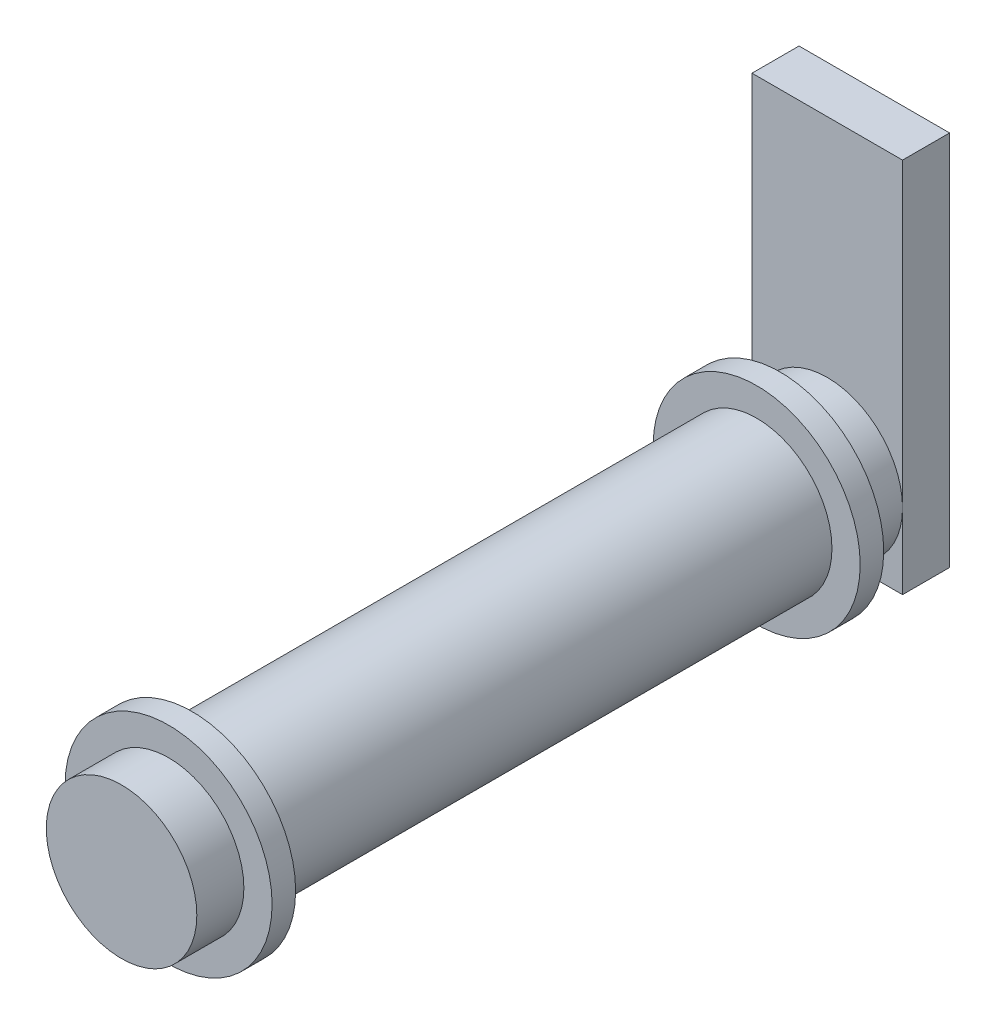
SolidWorks part; units mm, degrees
ref_plane "Plan de face" through (0, 0, 0) normal (0, 0, 1) x (1, 0, 0)
ref_plane "Plan de dessus" through (0, 0, 0) normal (0, 1, 0) x (1, 0, 0)
ref_plane "Plan de droite" through (0, 0, 0) normal (1, 0, 0) x (0, 0, -1)
sketch "Esquisse1" plane through (0, 0, 0) normal (0, 0, 1) x (1, 0, 0)
  circle A0 centre (0, 0) radius 16
extrude "Boss.-Extru.1" add sketch "Esquisse1" along normal blind 150
sketch "Esquisse2" plane through (0, 0, 0) normal (0, 0, -1) x (-1, 0, 0)
  line L1 (-16, -16) -> (16, -16)
  line L2 (-16, -16) -> (-16, 64)
  line L3 (-16, 64) -> (16, 64)
  line L4 (16, -16) -> (16, 64)
  dimension "D1" = 32
  dimension "D2" = 16
  dimension "D3" = 80
  dimension "D4" = 16
extrude "Boss.-Extru.2" add sketch "Esquisse2" along normal blind 10
ref_plane "Plan1" through (0, 0, 10) normal (0, 0, 1) x (1, 0, 0)
sketch "Esquisse3" plane through (0, 0, 10) normal (0, 0, 1) x (1, 0, 0)
  circle A0 centre (0, 0) radius 22
extrude "Boss.-Extru.3" add sketch "Esquisse3" along normal blind 5
pattern_linear "Répétition linéaire1" count 2 spacing 125 along (0, 0, 1) of "Boss.-Extru.3"
